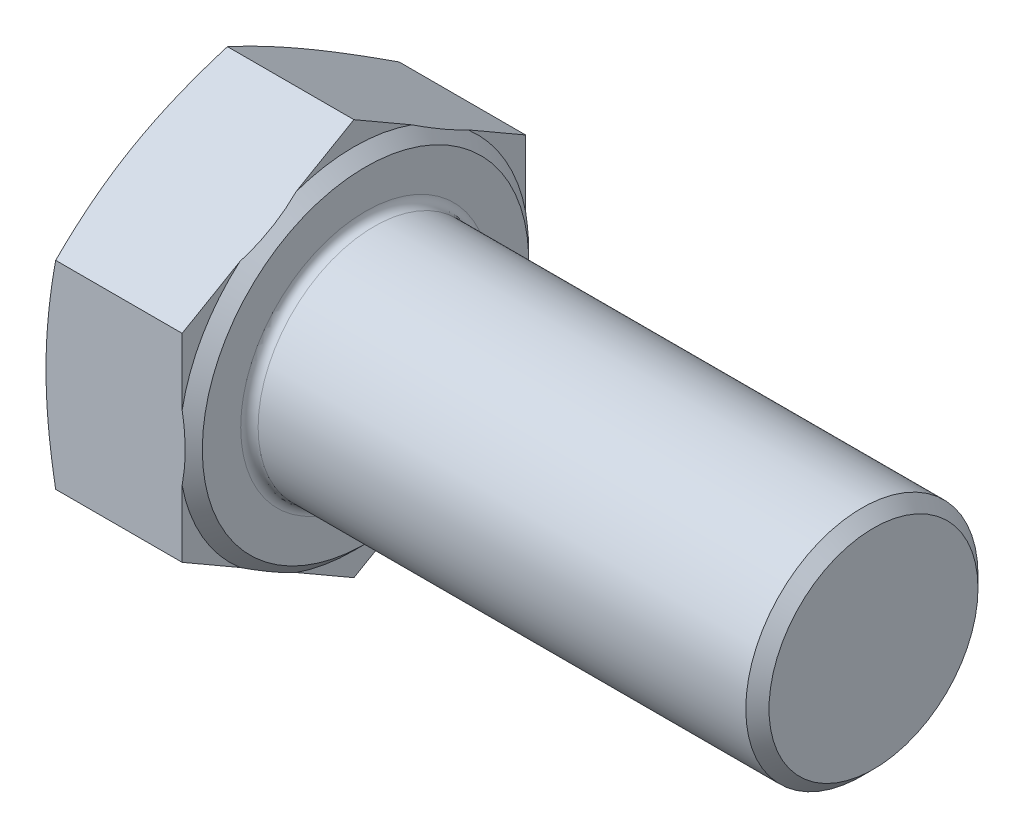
SolidWorks part; units mm, degrees
ref_plane "Front" through (0, 0, 0) normal (0, 0, 1) x (1, 0, 0)
ref_plane "Top" through (0, 0, 0) normal (0, 1, 0) x (1, 0, 0)
ref_plane "Right" through (0, 0, 0) normal (1, 0, 0) x (0, 0, -1)
sketch "Sketch2" plane through (0, 0, 0) normal (1, 0, 0) x (0, 0, -1)
  line L1 (11.835, -6.8329) -> (11.835, 6.8329)
  line L2 (11.835, 6.8329) -> (0, 13.6659)
  line L3 (0, 13.6659) -> (-11.835, 6.8329)
  line L4 (-11.835, 6.8329) -> (-11.835, -6.8329)
  line L5 (-11.835, -6.8329) -> (0, -13.6659)
  line L6 (0, -13.6659) -> (11.835, -6.8329)
  circle A0 centre (0, 0) radius 11.835 construction
  dimension "s" = 23.67
extrude "BaseHead" add sketch "Sketch2" along normal blind 10.18
sketch "Sketch3" plane through (0, 0, 0) normal (0, 0, 1) x (1, 0, 0)
  line L0 (10.18, 13.6659) -> (10.18, 11.245)
  line L2 (10.18, 11.245) -> (9.38, 12.045)
  line L3 (9.38, 12.045) -> (9.38, 13.6659)
  line L5 (9.38, 13.6659) -> (10.18, 13.6659)
  line L6 (-0.9571, 0) -> (7.6478, 0) construction
  line L7 (10.18, 13.6659) -> (0, 13.6659) construction
  dimension "D1" = 45
  dimension "c" = 0.8
  dimension "dw" = 22.49
revolve "BearingFace" cut sketch "Sketch3" angle 360 about L6
sketch "Sketch4" plane through (0, 0, 0) normal (0, 0, 1) x (1, 0, 0)
  line L0 (-0.4935, 0) -> (3.5626, 0) construction
  line L2 (0, 13.6659) -> (0.6664, 13.6659)
  line L4 (0.6664, 13.6659) -> (0, 11.835)
  line L6 (0, 11.835) -> (0, 13.6659)
  line L7 (9.38, 13.6659) -> (0, 13.6659) construction
  dimension "D1" = 20
  dimension "D2" = 23.67
revolve "HeadChamfer" cut sketch "Sketch4" angle 360 about L0
sketch "Sketch5" plane through (10.18, 0, 0) normal (1, 0, 0) x (0, 0, -1)
  circle A0 centre (0, 0) radius 8
  dimension "d" = 16
extrude "BaseBody" add sketch "Sketch5" along normal blind 35
chamfer "Chamfer1" distance 0.8 angle 45 1 edges at (45.18, 0, -8)
fillet "HeadFillet" radius 0.6 1 edges at (10.18, 0, -8)
equation "\"D2@Sketch4\" = \"s@Sketch2\""
equation "\"D1@Chamfer1\" = 0.05 * \"d@Sketch5\""
